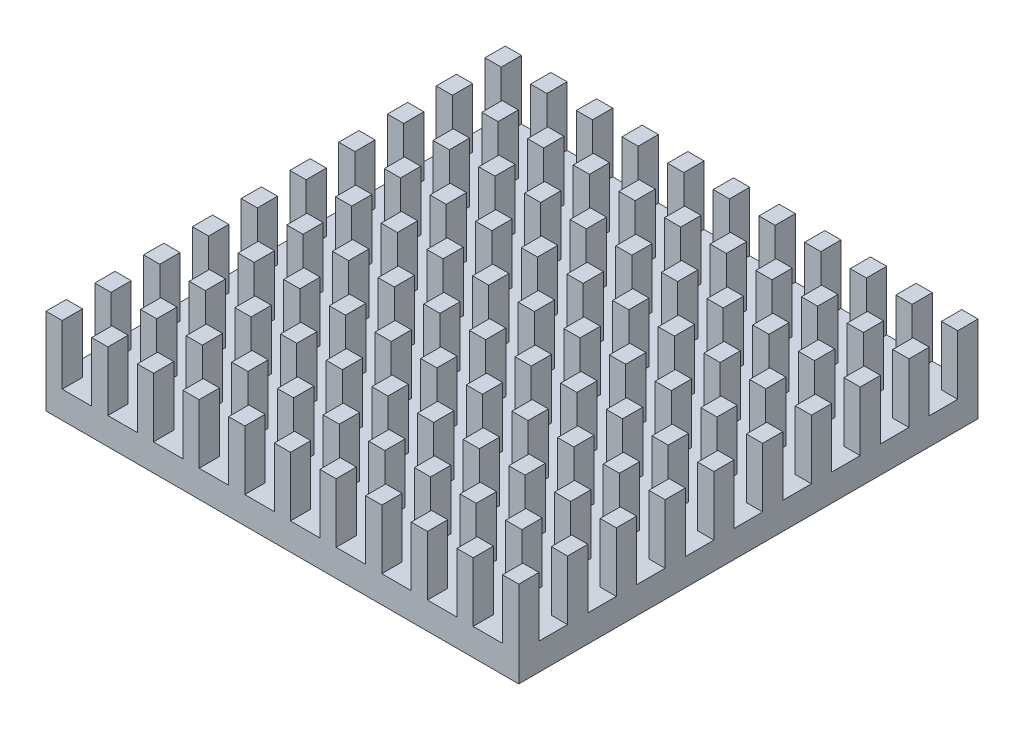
SolidWorks part; units mm, degrees
ref_plane "Front Plane" through (0, 0, 0) normal (0, 0, 1) x (1, 0, 0)
ref_plane "Top Plane" through (0, 0, 0) normal (0, 1, 0) x (1, 0, 0)
ref_plane "Right Plane" through (0, 0, 0) normal (1, 0, 0) x (0, 0, -1)
imported_body "Imported1"
sketch "Sketch1" plane through (0, 0, 21.59) normal (0, 0, 1) x (1, 0, 0)
  line L1 (0, 8.128) -> (46.1688, 8.128)
  line L2 (0, 8.128) -> (0, 13.9876)
  line L3 (0, 13.9876) -> (46.1688, 13.9876)
  line L4 (46.1688, 8.128) -> (46.1688, 13.9876)
extrude "Cut-Extrude1" cut sketch "Sketch1" against normal through all
sketch "Sketch2" plane through (0, 0, 21.59) normal (0, 0, 1) x (1, 0, 0)
  line L1 (1.524, 3.9243) -> (4.2926, 3.9243)
  line L2 (1.524, 3.9243) -> (1.524, 2.54)
  line L3 (1.524, 2.54) -> (4.2926, 2.54)
  line L4 (4.2926, 3.9243) -> (4.2926, 2.54)
  arc A0 (1.524, 3.9243) -> (4.2926, 3.9243) centre (2.9083, 3.9243) ccw construction
extrude "Cut-Extrude2" cut sketch "Sketch2" against normal through all
pattern_linear "LPattern1" count 10 spacing 4.2926 of "Cut-Extrude2"
